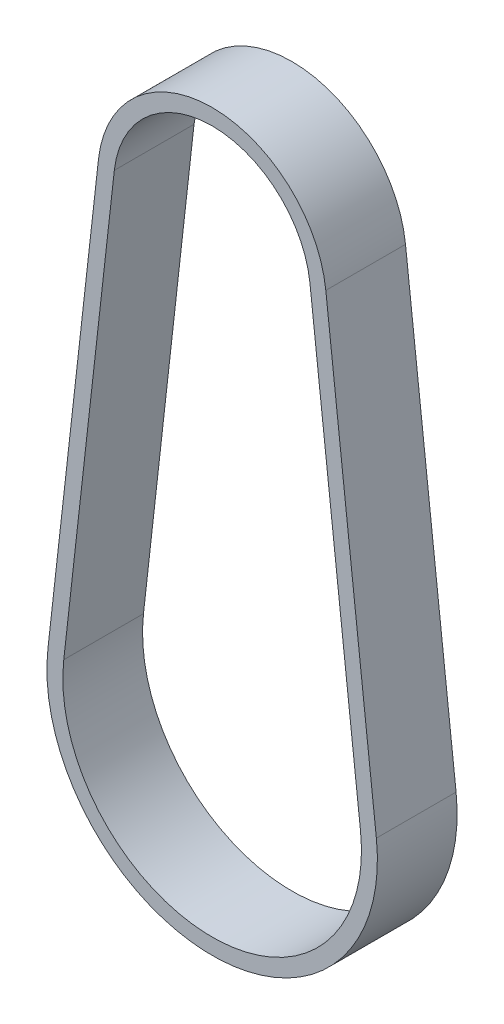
SolidWorks part; units mm, degrees
ref_plane "Front Plane" through (0, 0, 0) normal (0, 0, 1) x (1, 0, 0)
ref_plane "Top Plane" through (0, 0, 0) normal (0, 1, 0) x (1, 0, 0)
ref_plane "Right Plane" through (0, 0, 0) normal (1, 0, 0) x (0, 0, -1)
sketch "Sketch2" plane through (0, 0, 0) normal (0, 0, 1) x (1, 0, 0)
  line L0 (0, 0) -> (1, 0) construction
  line L1 (0, 0) -> (0, 1) construction
  line L4 (19.4024, 2.1844) -> (28.9173, -82.3282)
  line L5 (-28.9173, -82.3282) -> (-19.4024, 2.1844)
  arc A1 (-19.4024, 2.1844) -> (19.4024, 2.1844) centre (0, 0) cw
  arc A2 (28.9173, -82.3282) -> (-28.9173, -82.3282) centre (0, -85.5838) cw
extrude "Extrude-Thin1" add sketch "Sketch2" along normal mid plane 15 thin
